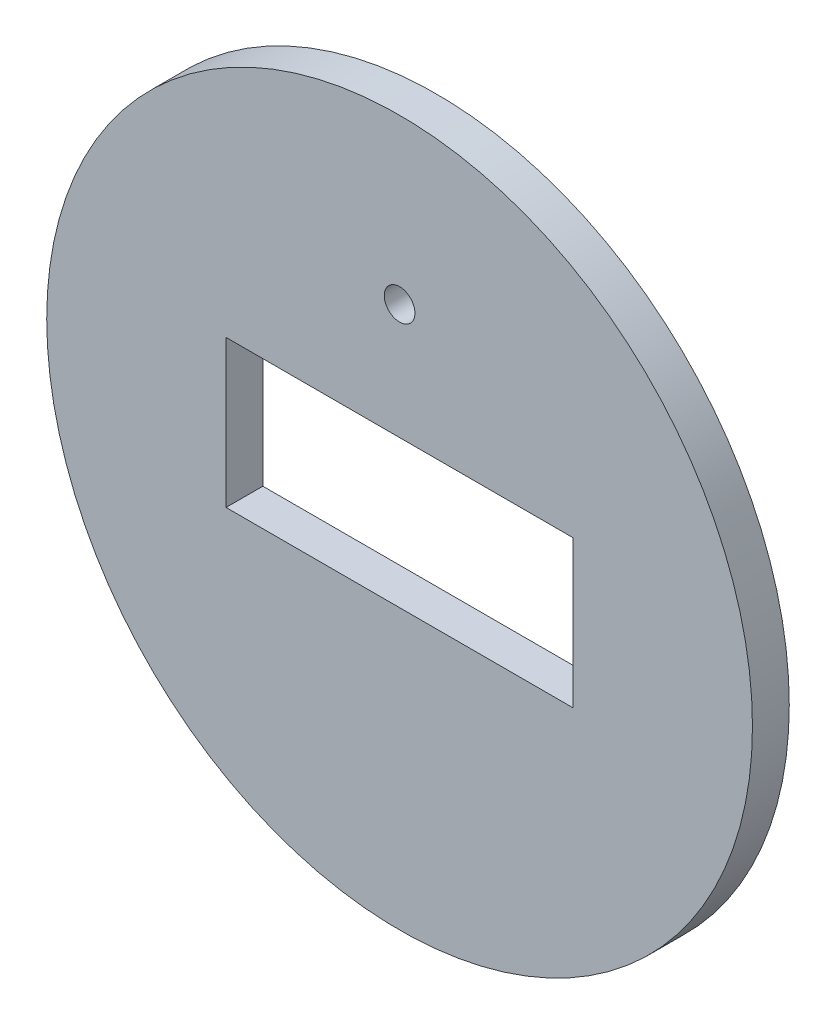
SolidWorks part; units mm, degrees
ref_plane "Front Plane" through (0, 0, 0) normal (0, 0, 1) x (1, 0, 0)
ref_plane "Top Plane" through (0, 0, 0) normal (0, 1, 0) x (1, 0, 0)
ref_plane "Right Plane" through (0, 0, 0) normal (1, 0, 0) x (0, 0, -1)
sketch "Sketch1" plane through (0, 0, 0) normal (0, 0, 1) x (1, 0, 0)
  circle A0 centre (0, 0) radius 36.5125
  dimension "D1" = 73.025
extrude "Extrude1" add sketch "Sketch1" along normal blind 3.81
sketch "Sketch2" plane through (0, 0, 0) normal (0, 0, 1) x (1, 0, 0)
  circle A0 centre (0, 19.558) radius 1.5875
  dimension "D1" = 3.175
  dimension "D2" = 19.558
extrude "Cut-Extrude1" cut sketch "Sketch2" along normal through all
sketch "Sketch3" plane through (0, 0, 0) normal (0, 0, 1) x (1, 0, 0)
  line L0 (0, -28.7416) -> (0, 27.6728) construction
  line L1 (-36.5125, 0) -> (36.5125, 0) construction
  line L2 (-17.9578, 7.62) -> (17.9578, 7.62)
  line L3 (-17.9578, 7.62) -> (-17.9578, -7.62)
  line L4 (17.9578, 7.62) -> (17.9578, -7.62)
  line L5 (17.9578, -7.62) -> (-17.9578, -7.62)
  circle A0 centre (0, 0) radius 36.5125 construction
  dimension "D1" = 35.9156
  dimension "D2" = 17.9578
  dimension "D3" = 15.24
  dimension "D4" = 7.62
extrude "Cut-Extrude2" cut sketch "Sketch3" along normal through all
